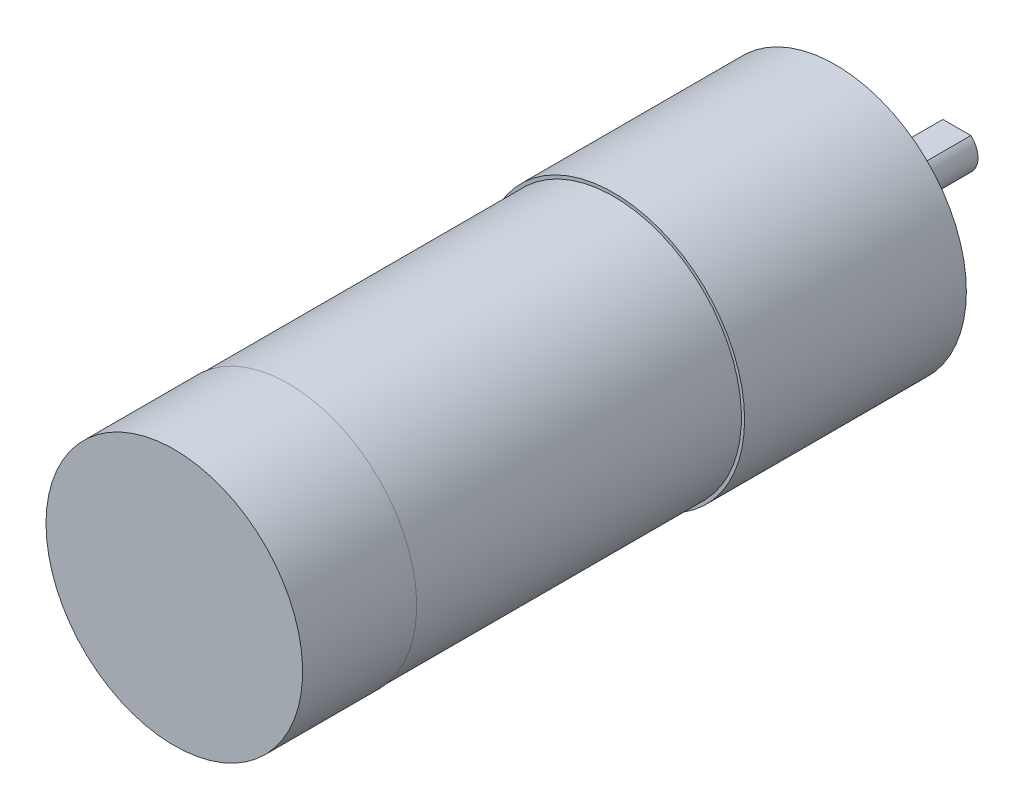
SolidWorks part; units mm, degrees
ref_plane "前视基准面" through (0, 0, 0) normal (0, 0, 1) x (1, 0, 0)
ref_plane "上视基准面" through (0, 0, 0) normal (0, 1, 0) x (1, 0, 0)
ref_plane "右视基准面" through (0, 0, 0) normal (1, 0, 0) x (0, 0, -1)
other "Configuration Table"
sketch "草图1" plane through (0, 0, 0) normal (0, 0, 1) x (1, 0, 0)
  circle A0 centre (0, 0) radius 12.4
  dimension "D1" = 24.8
extrude "凸台-拉伸1" add sketch "草图1" along normal blind 21
sketch "草图2" plane through (0, 0, 21) normal (0, 0, 1) x (1, 0, 0)
  circle A0 centre (0, 0) radius 12.1
  dimension "D1" = 24.2
extrude "凸台-拉伸2" add sketch "草图2" along normal blind 30.8
sketch "草图3" plane through (0, 0, 51.8) normal (0, 0, 1) x (1, 0, 0)
  circle A0 centre (0, 0) radius 12.15
  dimension "D1" = 24.3
extrude "凸台-拉伸3" add sketch "草图3" along normal blind 10.8
sketch "草图4" plane through (0, 0, 0) normal (0, 0, -1) x (-1, 0, 0)
  circle A0 centre (0, 0) radius 3.5
  dimension "D1" = 7
extrude "凸台-拉伸4" add sketch "草图4" along normal blind 2.5
sketch "草图5" plane through (0, 0, -2.5) normal (0, 0, -1) x (-1, 0, 0)
  circle A0 centre (0, 0) radius 2
  dimension "D1" = 4
extrude "凸台-拉伸5" add sketch "草图5" along normal blind 9
sketch "草图6" plane through (0, 0, -11.5) normal (0, 0, -1) x (-1, 0, 0)
  line L0 (-1.3229, 1.5) -> (1.3229, 1.5)
  circle A0 centre (0, 0) radius 2 construction
  arc A1 (1.3229, 1.5) -> (-1.3229, 1.5) centre (0, 0) ccw
  dimension "D1" = 1.5
extrude "切除-拉伸1" cut sketch "草图6" against normal blind 9
hole_wizard "M3 螺纹孔1" positions "草图8" profile "草图9" tap size "M3" standard "DIN"
sketch "草图8" plane through (0, 0, 0) normal (0, 0, -1) x (-1, 0, 0)
  line L0 (0, 0) -> (5.5183, 0) construction
  line L2 (0, 0) -> (0, 7.7773) construction
  point P0 (-8.5, 0)
  point P2 (8.5, 0)
  dimension "D1" = 8.5
  dimension "D2" = 8.5
sketch "草图9" plane through (8.5, 0, 0) normal (1, 0, 0) x (0, 1, 0)
  line L0 (0, 0) -> (0, 5.7511)
  line L1 (0, 5.7511) -> (1.25, 5)
  line L2 (1.25, 5) -> (1.25, 0)
  line L5 (1.25, 0) -> (0, 0)
  line L10 (0, 5.7511) -> (-1.25, 5) construction
  line L11 (0, -6.35) -> (0, 107.95) construction
  dimension "螺纹孔钻头直径" = 2.5
  dimension "螺纹孔钻头深度" = 5
  dimension "导头角度" = 118
